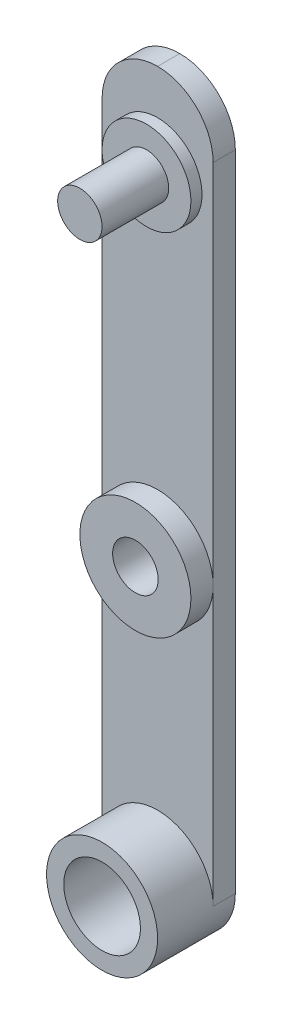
SolidWorks part; units mm, degrees
ref_plane "Plan de face" through (0, 0, 0) normal (0, 0, 1) x (1, 0, 0)
ref_plane "Plan de dessus" through (0, 0, 0) normal (0, 1, 0) x (1, 0, 0)
ref_plane "Plan de droite" through (0, 0, 0) normal (1, 0, 0) x (0, 0, -1)
sketch "Esquisse1" plane through (0, 0, 0) normal (0, 0, 1) x (1, 0, 0)
  line L0 (0, 57.8302) -> (0, -54.6226) construction
  line L1 (-12.0368, -30) -> (22.7958, -30) construction
  line L2 (-5, 38) -> (5, 38)
  line L3 (-5, 38) -> (-5, -25)
  line L5 (5, 38) -> (5, -25)
  arc A0 (-5, -25) -> (5, -25) centre (0, -25) ccw
  dimension "D1" = 10
  dimension "D2" = 30
  dimension "D3" = 38
extrude "Boss.-Extru.1" add sketch "Esquisse1" along normal blind 2
sketch "Esquisse2" plane through (0, 0, 2) normal (0, 0, 1) x (1, 0, 0)
  circle A0 centre (0, 0) radius 2.05
  dimension "D2" = 4.1
sketch "Esquisse3" plane through (0, 0, 2) normal (0, 0, 1) x (1, 0, 0)
  line L0 (5, 38) -> (5, -25) construction
  circle A0 centre (0, 0) radius 5
extrude "Enlèv. mat.-Extru.1" cut sketch "Esquisse2" against normal blind 10
sketch "Esquisse4" plane through (0, 0, 2) normal (0, 0, 1) x (1, 0, 0)
  line L0 (0, 57.8302) -> (0, -54.6226) construction
  circle A0 centre (0, 30) radius 4
  dimension "D1" = 8
  dimension "D2" = 30
extrude "Boss.-Extru.2" add sketch "Esquisse4" along normal blind 1
sketch "Esquisse5" plane through (0, 0, 3) normal (0, 0, 1) x (1, 0, 0)
  circle A0 centre (0, 30) radius 2
  dimension "D1" = 4
extrude "Boss.-Extru.3" add sketch "Esquisse5" along normal blind 6
sketch "Esquisse6" plane through (0, 0, 2) normal (0, 0, 1) x (1, 0, 0)
  circle A0 centre (0, 0) radius 2.05
  circle A1 centre (0, 0) radius 5
extrude "Boss.-Extru.4" add sketch "Esquisse6" along normal blind 2
fillet "Congé1" radius 5 2 edges at (5, 38, 1) (-5, 38, 1)
sketch "Esquisse7" plane through (0, 0, 2) normal (0, 0, 1) x (1, 0, 0)
  circle A0 centre (0, -25) radius 5
extrude "Boss.-Extru.5" add sketch "Esquisse7" along normal blind 5
sketch "Esquisse8" plane through (0, 0, 7) normal (0, 0, 1) x (1, 0, 0)
  circle A0 centre (0, -25) radius 3.4543
extrude "Enlèv. mat.-Extru.2" cut sketch "Esquisse8" against normal through all
